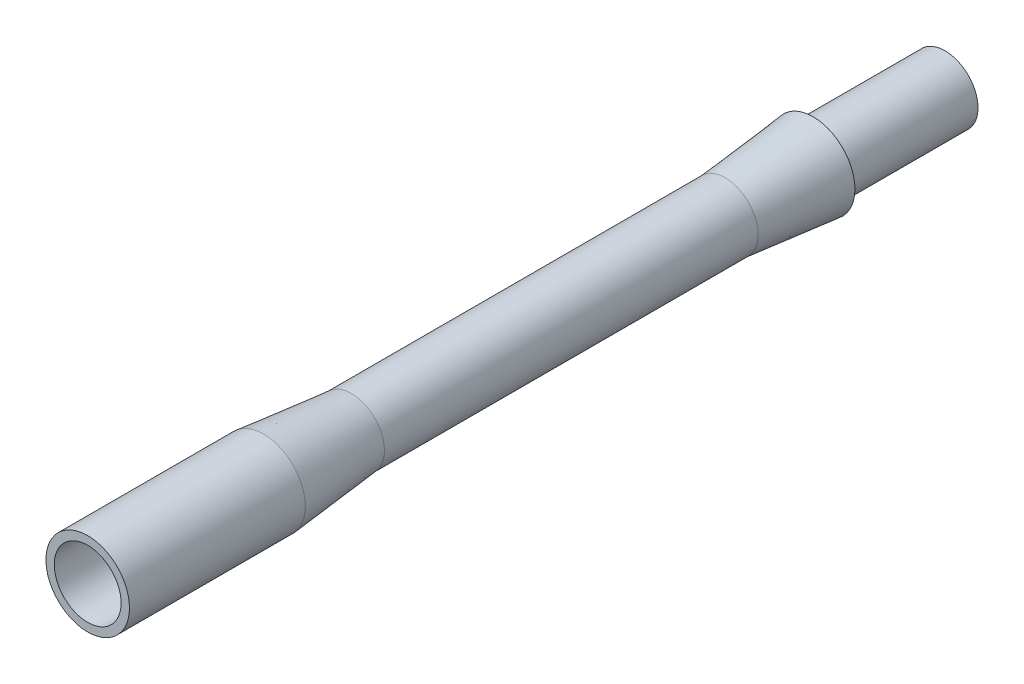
SolidWorks part; units mm, degrees
ref_plane "Front Plane" through (0, 0, 0) normal (0, 0, 1) x (1, 0, 0)
ref_plane "Top Plane" through (0, 0, 0) normal (0, 1, 0) x (1, 0, 0)
ref_plane "Right Plane" through (0, 0, 0) normal (1, 0, 0) x (0, 0, -1)
sketch "Sketch1" plane through (0, 0, 0) normal (0, 0, 1) x (1, 0, 0)
  circle A0 centre (0, 0) radius 7.6
  circle A1 centre (0, 0) radius 9.5
  dimension "D1" = 15.2
  dimension "D2" = 19
extrude "Boss-Extrude1" add sketch "Sketch1" against normal blind 40
sketch "Sketch2" plane through (0, 0, -40) normal (0, 0, -1) x (-1, 0, 0)
  circle A0 centre (0, 0) radius 7.5
  circle A1 centre (0, 0) radius 6.5
  dimension "D1" = 15
  dimension "D2" = 13
extrude "Boss-Extrude2" add sketch "Sketch2" along normal blind 125 separate body
sketch "Sketch3" plane through (0, 0, 0) normal (1, 0, 0) x (0, 0, -1)
  line L0 (40, 7.5) -> (40, 9.5)
  line L1 (60, 7.5) -> (40, 7.5)
  line L2 (60, 7.5) -> (40, 9.5)
  line L3 (165, 7.5) -> (40, 7.5) construction
  line L4 (40, 0) -> (49.5295, 0)
  line L5 (40, -9.5) -> (40, 9.5) construction
revolve "Revolve1" add sketch "Sketch3" angle 360 about L4
sketch "Sketch4" plane through (0, 0, -165) normal (0, 0, -1) x (-1, 0, 0)
  circle A0 centre (0, 0) radius 6.5
  circle A1 centre (0, 0) radius 5.75
  dimension "D1" = 11.5
extrude "Boss-Extrude3" add sketch "Sketch4" against normal up to surface (125 mm away)
sketch "Sketch5" plane through (0, 0, -165) normal (0, 0, -1) x (-1, 0, 0)
  circle A0 centre (0, 0) radius 5.75
  circle A1 centre (0, 0) radius 7.5
  dimension "D1" = 11.5
extrude "Boss-Extrude4" add sketch "Sketch5" along normal blind 30
sketch "Sketch6" plane through (0, 0, 0) normal (1, 0, 0) x (0, 0, -1)
  line L0 (195, 0) -> (185.163, 0)
  line L1 (195, 7.5) -> (60, 7.5) construction
  line L2 (165, 7.5) -> (165, 9.5)
  line L3 (165, 7.5) -> (145, 7.5)
  line L4 (145, 7.5) -> (165, 9.5)
  line L5 (195, -7.5) -> (195, 7.5) construction
  dimension "D2" = 2
  dimension "D3" = 20
revolve "Revolve2" add sketch "Sketch6" angle 360 about L0
sketch "Sketch7" plane through (0, 0, 0) normal (1, 0, 0) x (0, 0, -1)
  line L0 (40, 0) -> (37.2181, 0)
  line L1 (40, 9.5) -> (40, -9.5) construction
  line L2 (40, 5.75) -> (40, 7.6)
  line L4 (40, 5.75) -> (38.15, 7.6)
  line L5 (40, 7.6) -> (0, 7.6) construction
  line L6 (38.15, 7.6) -> (40, 7.6)
revolve "Revolve3" add sketch "Sketch7" angle 360 about L0
